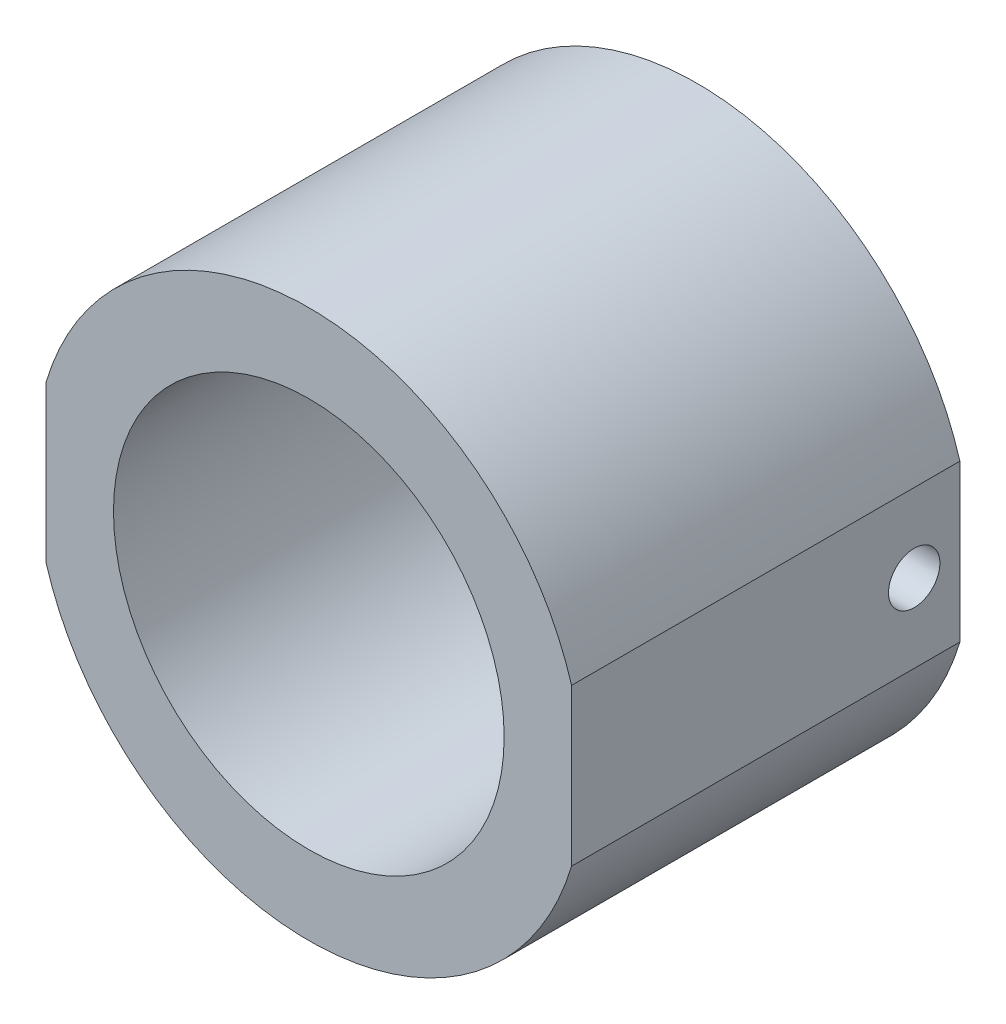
SolidWorks part; units mm, degrees
ref_plane "前视基准面" through (0, 0, 0) normal (0, 0, 1) x (1, 0, 0)
ref_plane "上视基准面" through (0, 0, 0) normal (0, 1, 0) x (1, 0, 0)
ref_plane "右视基准面" through (0, 0, 0) normal (1, 0, 0) x (0, 0, -1)
other "Configuration Table"
sketch "草图1" plane through (0, 0, 0) normal (0, 0, 1) x (1, 0, 0)
  circle A0 centre (0, 0) radius 24
  circle A1 centre (0, 0) radius 17.1
  dimension "D1" = 34.2
  dimension "D2" = 48
extrude "Wrist_Housing_OD48_ID34_2" add sketch "草图1" against normal mid plane 34
sketch "草图2" plane through (0, 0, 0) normal (0, 0, 1) x (1, 0, 0)
  line L1 (23, -30) -> (37, -30)
  line L2 (23, -30) -> (23, 30)
  line L3 (23, 30) -> (37, 30)
  line L4 (37, -30) -> (37, 30)
  line L5 (23, -30) -> (37, 30) construction
  line L6 (23, 30) -> (37, -30) construction
  line L7 (-37, -30) -> (-23, -30)
  line L8 (-37, -30) -> (-37, 30)
  line L9 (-37, 30) -> (-23, 30)
  line L10 (-23, -30) -> (-23, 30)
  line L11 (-37, -30) -> (-23, 30) construction
  line L12 (-37, 30) -> (-23, -30) construction
  point P0 (30, 0)
  point P5 (-30, 0)
  dimension "D1" = 23
  dimension "D2" = 30
  dimension "D3" = 23
  dimension "D4" = 30
extrude "Housing_Mounting_Flats_X23" cut sketch "草图2" against normal mid plane 500
sketch "草图3" plane through (0, 0, 0) normal (1, 0, 0) x (0, 0, -1)
  circle A0 centre (13, 0) radius 2.25
  dimension "D1" = 4.5
  dimension "D2" = 13
extrude "Stator_Side_Screw_Clearance_D4_5" cut sketch "草图3" against normal mid plane 500
